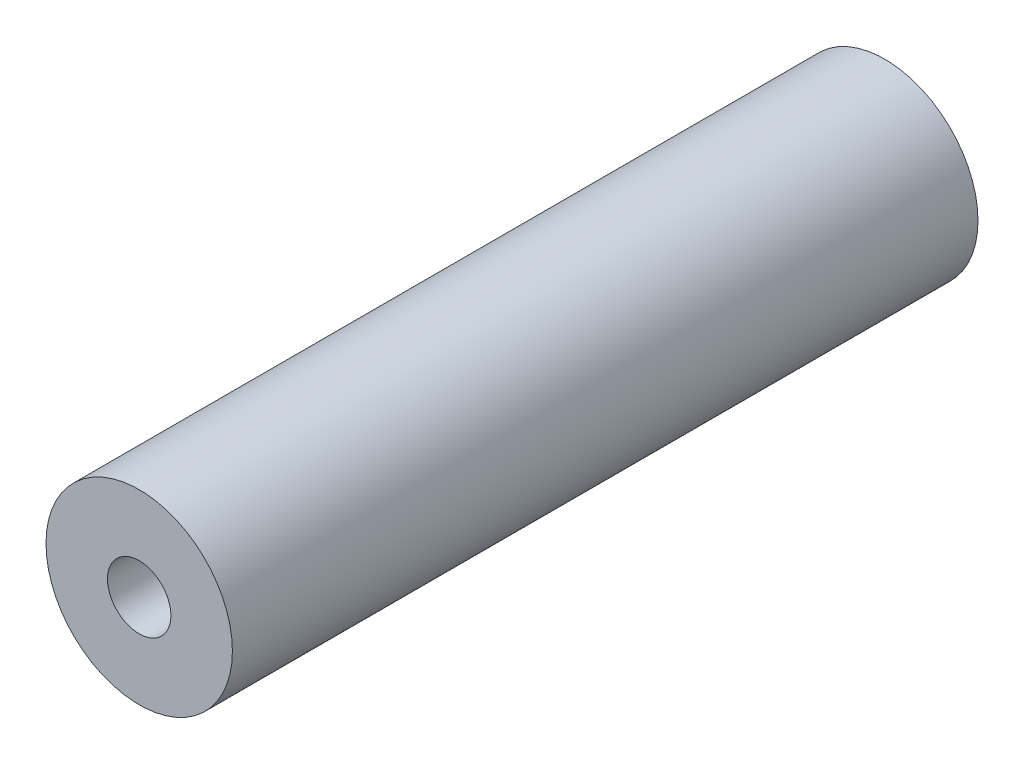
SolidWorks part; units mm, degrees
ref_plane "Front" through (0, 0, 0) normal (0, 0, 1) x (1, 0, 0)
ref_plane "Top" through (0, 0, 0) normal (0, 1, 0) x (1, 0, 0)
ref_plane "Right" through (0, 0, 0) normal (1, 0, 0) x (0, 0, -1)
sketch "Sketch1" plane through (0, 0, 0) normal (0, 0, 1) x (1, 0, 0)
  circle A0 centre (0, 0) radius 9.525
  circle A1 centre (0, 0) radius 3.2385
  dimension "D1" = 19.05
  dimension "D2" = 6.477
extrude "Boss-Extrude1" add sketch "Sketch1" along normal mid plane 76.2
